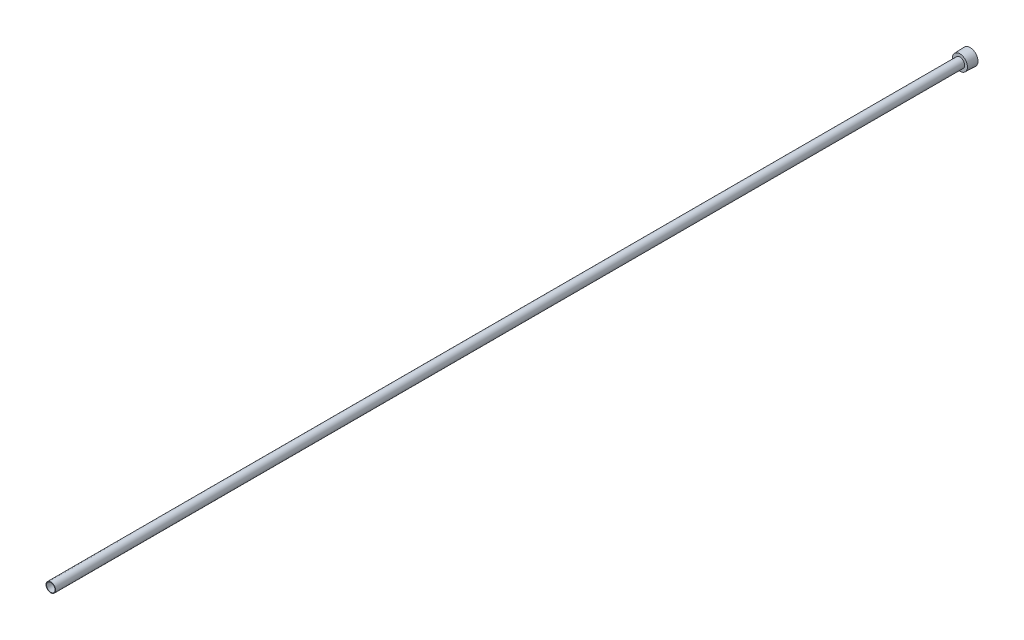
SolidWorks part; units mm, degrees
ref_plane "Front Plane" through (0, 0, 0) normal (0, 0, 1) x (1, 0, 0)
ref_plane "Top Plane" through (0, 0, 0) normal (0, 1, 0) x (1, 0, 0)
ref_plane "Right Plane" through (0, 0, 0) normal (1, 0, 0) x (0, 0, -1)
sketch "Sketch1" plane through (0, 0, 0) normal (1, 0, 0) x (0, 0, -1)
  line L0 (-223.2122, 0) -> (49776.7878, 0) construction
  line L6 (0, 10.541) -> (-13.4874, 10.049)
  line L7 (0, 0) -> (0, 10.541)
  line L8 (-13.4874, 10.049) -> (-13.4874, 6.35)
  line L9 (-13.4874, 6.35) -> (-1219.2, 6.35)
  line L10 (-1219.2, 6.35) -> (-1219.2, 0)
  line L11 (0, 0) -> (-1219.2, 0)
  dimension "D1" = 2.089
  dimension "D2" = 13.4874
  dimension "D3" = 21.082
  dimension "D4" = 12.7
  dimension "D5" = 1219.2
revolve "Revolve1" add sketch "Sketch1" angle 360 about L0
sketch "Sketch2" plane through (0, 0, 1219.2) normal (0, 0, 1) x (1, 0, 0)
  circle A0 centre (0, 0) radius 5.6388
  dimension "D1" = 11.2776
extrude "Cut-Extrude1" cut sketch "Sketch2" against normal through all
sketch "Sketch3" plane through (0, 0, 0) normal (0, 0, -1) x (-1, 0, 0)
  line L0 (0, 11.5951) -> (0, -11.5951) construction
  line L1 (0, -7.3323) -> (6.35, -3.6662)
  line L2 (6.35, -3.6662) -> (6.35, 3.6662)
  line L3 (6.35, 3.6662) -> (0, 7.3323)
  line L4 (0, 7.3323) -> (-6.35, 3.6662)
  line L5 (-6.35, 3.6662) -> (-6.35, -3.6662)
  line L6 (-6.35, -3.6662) -> (0, -7.3323)
  circle A0 centre (0, 0) radius 6.35 construction
  dimension "D1" = 12.7
extrude "Cut-Extrude2" cut sketch "Sketch3" against normal blind 9.525
